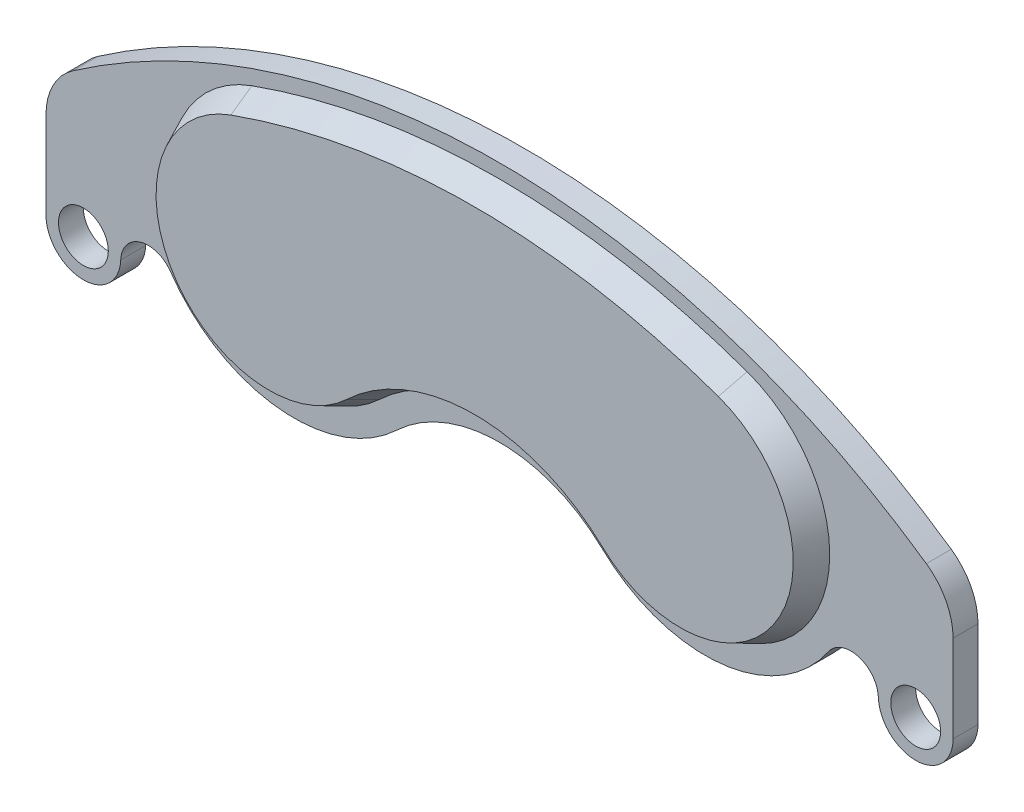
SolidWorks part; units mm, degrees
ref_plane "Front Plane" through (0, 0, 0) normal (0, 0, 1) x (1, 0, 0)
ref_plane "Top Plane" through (0, 0, 0) normal (0, 1, 0) x (1, 0, 0)
ref_plane "Right Plane" through (0, 0, 0) normal (1, 0, 0) x (0, 0, -1)
sketch "Sketch1" plane through (0, 0, 0) normal (0, 0, 1) x (1, 0, 0)
  line L0 (0, 0) -> (0, 100.7079) construction
  line L1 (-46.228, 57.3478) -> (-46.228, 48.4578)
  line L2 (46.228, 57.3478) -> (46.228, 48.4578)
  arc A0 (-43.5033, 62.5612) -> (43.5033, 62.5612) centre (0, 0) cw
  arc A1 (-43.5033, 62.5612) -> (-46.228, 57.3478) centre (-39.878, 57.3478) ccw
  arc A2 (43.5033, 62.5612) -> (46.228, 57.3478) centre (39.878, 57.3478) cw
  arc A3 (-46.228, 48.4578) -> (-38.6107, 48.3134) centre (-42.418, 48.4578) ccw
  arc A4 (-38.6107, 48.3134) -> (-33.5159, 49.7898) centre (-35.8187, 48.2075) cw
  arc A5 (-33.5159, 49.7898) -> (-10.4775, 47.353) centre (-20.955, 58.42) ccw
  arc A6 (-10.4775, 47.353) -> (10.4775, 47.353) centre (0, 36.2859) cw
  arc A7 (10.4775, 47.353) -> (33.5159, 49.7898) centre (20.955, 58.42) ccw
  arc A8 (33.5159, 49.7898) -> (38.6107, 48.3134) centre (35.8187, 48.2075) cw
  arc A9 (38.6107, 48.3134) -> (46.228, 48.4578) centre (42.418, 48.4578) ccw
  dimension "D1" = 76.2
  dimension "D2" = 15.24
  dimension "D3" = 2.794
  dimension "D5" = 8.89
  dimension "D6" = 6.35
  dimension "D4" = 3.81
  dimension "D7" = 41.91
  dimension "D8" = 58.42
  dimension "D9" = 84.836
extrude "Boss-Extrude1" add sketch "Sketch1" along normal mid plane 2.54
sketch "Sketch2" plane through (0, 0, 1.27) normal (0, 0, 1) x (1, 0, 0)
  arc A13 (-25.2429, 70.3742) -> (25.2429, 70.3742) centre (0, 0) cw
  arc A14 (-25.2429, 70.3742) -> (-12.2237, 49.1975) centre (-20.955, 58.42) ccw
  arc A15 (-12.2237, 49.1975) -> (12.2237, 49.1975) centre (0, 36.2859) cw
  arc A16 (12.2237, 49.1975) -> (25.2429, 70.3742) centre (20.955, 58.42) ccw
  arc A18 (-33.5159, 49.7898) -> (-10.4775, 47.353) centre (-20.955, 58.42) ccw construction
  arc A19 (10.4775, 47.353) -> (-10.4775, 47.353) centre (0, 36.2859) ccw construction
  arc A20 (10.4775, 47.353) -> (33.5159, 49.7898) centre (20.955, 58.42) ccw construction
  arc A21 (43.5033, 62.5612) -> (-43.5033, 62.5612) centre (0, 0) ccw construction
  dimension "D1" = 12.7
extrude "Boss-Extrude2" add sketch "Sketch2" along normal blind 2.54 draft 25
sketch "Sketch3" plane through (0, 0, 1.27) normal (0, 0, 1) x (1, 0, 0)
  circle A0 centre (-42.418, 48.4578) radius 2.54
  circle A1 centre (42.418, 48.4578) radius 2.54
  dimension "D1" = 5.08
extrude "Cut-Extrude1" cut sketch "Sketch3" against normal up to next
